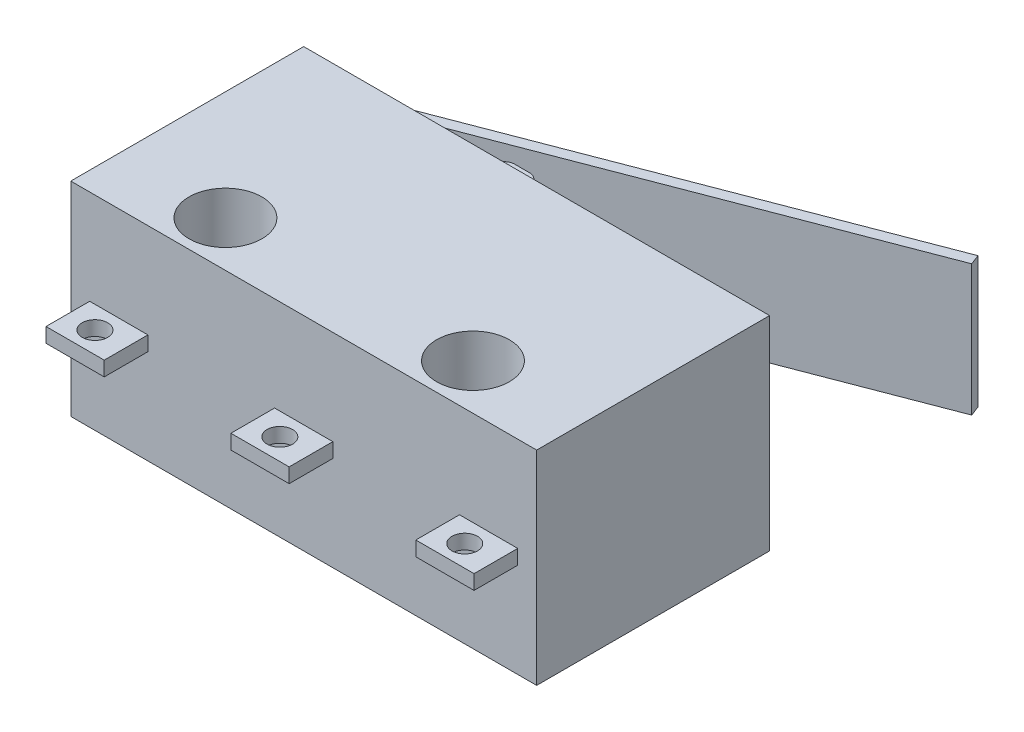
SolidWorks part; units mm, degrees
ref_plane "Plan de face" through (0, 0, 0) normal (0, 0, 1) x (1, 0, 0)
ref_plane "Plan de dessus" through (0, 0, 0) normal (0, 1, 0) x (1, 0, 0)
ref_plane "Plan de droite" through (0, 0, 0) normal (1, 0, 0) x (0, 0, -1)
sketch "Esquisse1" plane through (0, 0, 0) normal (0, 1, 0) x (1, 0, 0)
  line L0 (0, -2.5006) -> (0, 15.2598) construction
  line L1 (0, 0) -> (12.8, 0)
  line L2 (0, 0) -> (0, 6.4)
  line L3 (0, 6.4) -> (12.8, 6.4)
  line L4 (12.8, 0) -> (12.8, 6.4)
  line L5 (-3.2154, 0) -> (26.8884, 0) construction
  line L6 (-3.2154, 1.25) -> (4.1722, 1.25) construction
  line L7 (3, -2.1046) -> (3, 2.4602) construction
  line L8 (6.4, 8.6166) -> (6.4, -2.5006) construction
  circle A0 centre (3, 1.25) radius 1
  circle A1 centre (9.8, 1.25) radius 1
  dimension "D1" = 6.4
  dimension "D2" = 3
  dimension "D3" = 1.25
extrude "Extrusion1" add sketch "Esquisse1" along normal blind 5.6
sketch "Esquisse2" plane through (0, 0, -6.4) normal (0, 0, -1) x (-1, 0, 0)
  line L0 (0.4551, 0) -> (-13.6057, 0) construction
  line L1 (0.4551, 2.8) -> (-12.1307, 2.8) construction
  line L2 (-0.2945, 1.4) -> (-7.4277, 1.4) construction
  line L3 (-0.2945, 4.2) -> (-6.6176, 4.2) construction
  line L4 (-4, -0.8935) -> (-4, 6.1671) construction
  line L5 (-5, -0.8935) -> (-5, 6.1671) construction
  line L6 (0, -0.7605) -> (0, 6.3847) construction
  line L8 (-4, 1.4) -> (-5, 1.4)
  line L9 (-4, 1.4) -> (-4, 4.2)
  line L10 (-4, 4.2) -> (-5, 4.2)
  line L11 (-5, 1.4) -> (-5, 4.2)
  dimension "D1" = 2.8
  dimension "D2" = 1
  dimension "D3" = 4
  dimension "D4" = 1.4
  dimension "D5" = 2.8
extrude "Extrusion2" add sketch "Esquisse2" along normal blind 1.5
fillet "Congé1" radius 0.3 2 edges at (5, 2.8, -7.9) (4, 2.8, -7.9)
ref_plane "Plan1" through (0, 2.8, 0) normal (0, 1, 0) x (-1, 0, 0)
sketch "Esquisse3" plane through (0, 0, -6.4) normal (0, 0, -1) x (-1, 0, 0)
  line L0 (0, -0.3651) -> (0, 6.1788) construction
  line L1 (-1, 6.1788) -> (-1, -0.3651) construction
  line L2 (0.1805, 4.6) -> (-3.7968, 4.6) construction
  line L3 (-1.3, 6.1788) -> (-1.3, -0.4631) construction
  line L4 (0.6899, 1) -> (-3.6107, 1) construction
  line L5 (1.0426, 0) -> (-4.9724, 0) construction
  line L6 (-12.8, 5.6) -> (0, 5.6) construction
  line L8 (-1.3, 4.6) -> (-1, 4.6)
  line L9 (-1.3, 4.6) -> (-1.3, 1)
  line L10 (-1.3, 1) -> (-1, 1)
  line L11 (-1, 4.6) -> (-1, 1)
  dimension "D1" = 1
  dimension "D2" = 1
  dimension "D3" = 1
  dimension "D4" = 0.3
sketch "Esquisse4" plane through (0, 2.8, 0) normal (0, 1, 0) x (-1, 0, 0)
  line L0 (0, -9.202) -> (0, -2.699) construction
  line L1 (-1.15, -8.2386) -> (-1.15, -6.4) construction
  line L2 (1.2182, -6.9) -> (-1.7523, -6.9) construction
  line L3 (0.1805, -6.4) -> (-3.7968, -6.4) construction
  line L4 (-1.15, -6.9) -> (-13.2907, -11.5479) construction
  line L5 (2.1257, -6.4) -> (-7.3425, -6.4) construction
  line L6 (-1.15, -6.4) -> (-1.15, -6.728)
  line L7 (-1.3106, -6.9615) -> (-13.2907, -11.5479)
  arc A0 (-1.15, -6.728) -> (-1.3106, -6.9615) centre (-1.4, -6.728) cw
  dimension "D4" = 0.25
  dimension "D1" = 1.15
  dimension "D2" = 0.5
  dimension "D3" = 13
sweep "Balayage1" add profiles "Esquisse3" path "Esquisse4"
sketch "Esquisse6" plane through (0, 0, 0) normal (0, 0, 1) x (1, 0, 0)
  line L0 (-1.1647, 2.8) -> (15.3638, 2.8) construction
  line L1 (6.4, 7.4371) -> (6.4, -1.9171) construction
  line L2 (1.32, 6.5919) -> (1.32, -1.9171) construction
  line L3 (0, 5.6) -> (0, 0) construction
  line L4 (0, 5.6) -> (12.8, 5.6) construction
  line L5 (5.6, 3) -> (7.2, 3)
  line L6 (0.52, 3) -> (2.12, 3)
  line L7 (0.52, 3) -> (0.52, 2.6)
  line L8 (0.52, 2.6) -> (2.12, 2.6)
  line L9 (2.12, 3) -> (2.12, 2.6)
  line L10 (0.52, 3) -> (2.12, 2.6) construction
  line L11 (0.52, 2.6) -> (2.12, 3) construction
  line L12 (5.6, 3) -> (5.6, 2.6)
  line L13 (7.2, 3) -> (7.2, 2.6)
  line L14 (5.6, 2.6) -> (7.2, 2.6)
  line L15 (10.68, 3) -> (12.28, 3)
  line L16 (10.68, 3) -> (10.68, 2.6)
  line L17 (12.28, 3) -> (12.28, 2.6)
  line L18 (10.68, 2.6) -> (12.28, 2.6)
  point P10 (1.32, 2.8)
  dimension "D4" = 3
  dimension "D1" = 6.4
  dimension "D2" = 2.8
  dimension "D3" = 5.08
extrude "Boss.-Extru.1" add sketch "Esquisse6" along normal blind 1.2
sketch "Esquisse7" plane through (0, 2.6, 0) normal (0, -1, 0) x (1, 0, 0)
  circle A0 centre (1.2774, 0.613) radius 0.35
  circle A1 centre (6.3574, 0.613) radius 0.35
  circle A2 centre (11.4374, 0.613) radius 0.35
  dimension "D1" = 3
extrude "Enlèv. mat.-Extru.1" cut sketch "Esquisse7" against normal blind 0.5
